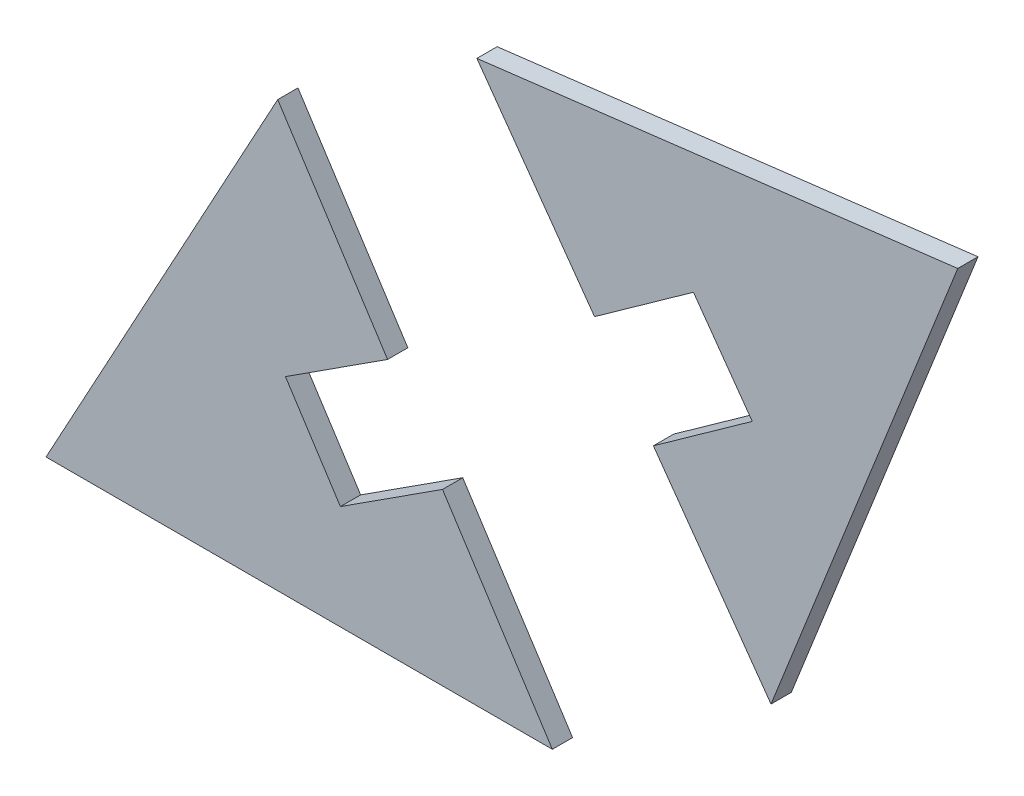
SolidWorks part; units mm, degrees
ref_plane "Front Plane" through (0, 0, 0) normal (0, 0, 1) x (1, 0, 0)
ref_plane "Top Plane" through (0, 0, 0) normal (0, 1, 0) x (1, 0, 0)
ref_plane "Right Plane" through (0, 0, 0) normal (1, 0, 0) x (0, 0, -1)
sketch "Sketch1" plane through (0, 0, 0) normal (0, 0, 1) x (1, 0, 0)
  line L0 (-16.2973, 32.9911) -> (-39.1793, -9.0162)
  line L1 (-39.1793, -9.0162) -> (10.8207, -9.0162)
  line L2 (10.8207, -9.0162) -> (-0.0265, 7.7867)
  line L3 (-5.4501, 16.1882) -> (-15.5319, 9.6799)
  line L4 (-15.5319, 9.6799) -> (-10.1083, 1.2784)
  line L5 (-10.1083, 1.2784) -> (-0.0265, 7.7867)
  line L6 (-5.4501, 16.1882) -> (-16.2973, 32.9911)
  line L7 (-13.759, 50.4122) -> (33.0815, -18.5632) construction
  line L8 (14.9888, 30.068) -> (3.3703, 46.3472)
  line L9 (30.5656, 28.8996) -> (20.7981, 21.9285)
  line L10 (24.7563, 37.0391) -> (30.5656, 28.8996)
  line L11 (14.9888, 30.068) -> (24.7563, 37.0391)
  line L12 (32.4166, 5.6493) -> (20.7981, 21.9285)
  line L13 (50.8553, 52.1253) -> (32.4166, 5.6493)
  line L14 (3.3703, 46.3472) -> (50.8553, 52.1253)
  dimension "D1" = 50
  dimension "D2" = 50
  dimension "D3" = 20
  dimension "D4" = 20
  dimension "D5" = 12
  dimension "D6" = 10
extrude "Boss-Extrude1" add sketch "Sketch1" along normal blind 2
